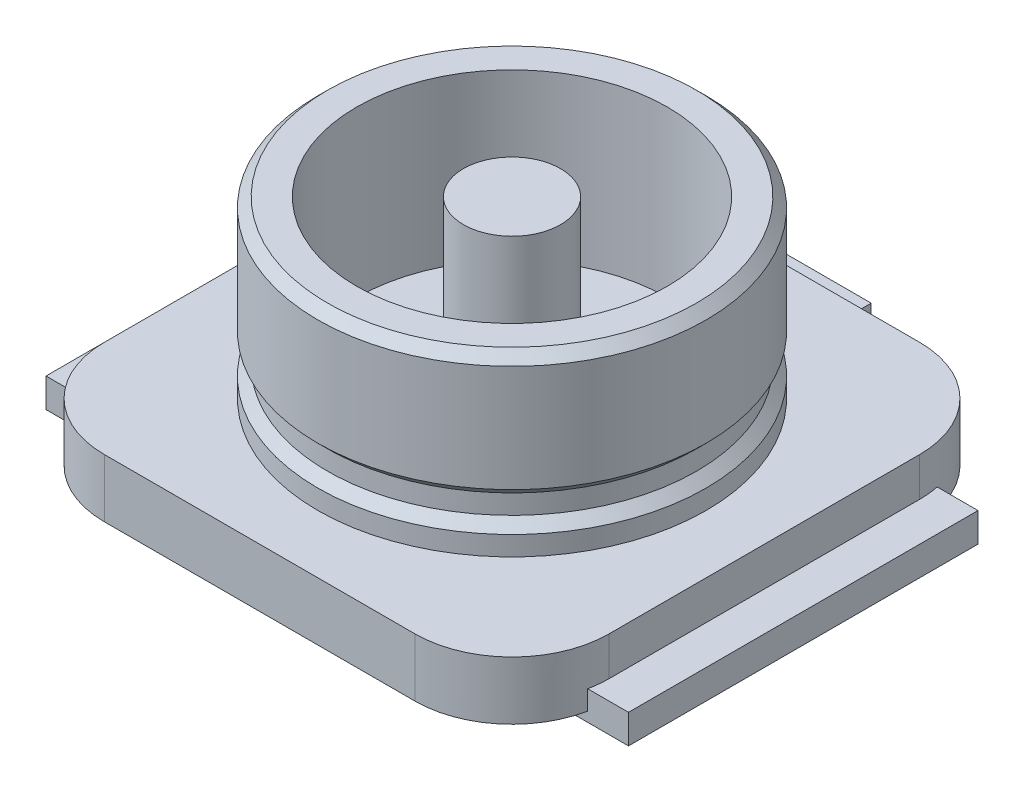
SolidWorks part; units mm, degrees
ref_plane "Front" through (0, 0, 0) normal (0, 0, 1) x (1, 0, 0)
ref_plane "Top" through (0, 0, 0) normal (0, 1, 0) x (1, 0, 0)
ref_plane "Right" through (0, 0, 0) normal (1, 0, 0) x (0, 0, -1)
sketch "Эскиз1" plane through (0, 0, 0) normal (0, 1, 0) x (1, 0, 0)
  line L0 (0, -1.3) -> (0, 1.3) construction
  line L1 (-0.8, -1.3) -> (0.8, -1.3)
  line L2 (-1.3, -0.8) -> (-1.3, 0.8)
  line L3 (-0.8, 1.3) -> (0.8, 1.3)
  line L4 (1.3, -0.8) -> (1.3, 0.8)
  arc A0 (-0.8, -1.3) -> (-1.3, -0.8) centre (-0.8, -0.8) cw
  arc A1 (-1.3, 0.8) -> (-0.8, 1.3) centre (-0.8, 0.8) cw
  arc A2 (0.8, 1.3) -> (1.3, 0.8) centre (0.8, 0.8) cw
  arc A3 (0.8, -1.3) -> (1.3, -0.8) centre (0.8, -0.8) ccw
  dimension "D1" = 0.5
  dimension "D2" = 2.6
extrude "Вытянуть1" add sketch "Эскиз1" along normal blind 0.3 from offset 0.05
sketch "Эскиз2" plane through (0, 0, 0) normal (0, 0, 1) x (1, 0, 0)
  line L0 (0, 0.35) -> (1, 0.35)
  line L1 (-0.8, 0.35) -> (0.8, 0.35) construction
  line L2 (1.3, 0.35) -> (0.8, 0.35) construction
  line L3 (1, 0.35) -> (1, 0.45)
  line L4 (1, 0.45) -> (0.95, 0.5)
  line L5 (0.95, 0.5) -> (0.95, 0.6)
  line L6 (0.95, 0.6) -> (1, 0.65)
  line L7 (1, 0.65) -> (1, 1.2)
  line L8 (1, 1.2) -> (0.95, 1.25)
  line L9 (0.95, 1.25) -> (0.8, 1.25)
  line L10 (0.8, 1.25) -> (0.8, 0.4)
  line L11 (0.8, 0.4) -> (0.25, 0.4)
  line L12 (0.25, 0.4) -> (0.25, 1.25)
  line L13 (0.25, 1.25) -> (0, 1.25)
  line L14 (0, 1.25) -> (0, 0.35) construction
  line L15 (0, 0.35) -> (0, 1.25)
  dimension "D1" = 1.25
  dimension "D2" = 2
  dimension "D3" = 45
  dimension "D4" = 0.1
  dimension "D5" = 0.1
  dimension "D6" = 0.5
  dimension "D7" = 0.05
  dimension "D8" = 1.6
  dimension "D9" = 1.9
revolve "Повернуть1" add sketch "Эскиз2" angle 360 about L14
sketch "Эскиз3" plane through (0, 0, 0) normal (0, 1, 0) x (1, 0, 0)
  line L0 (-0.2, 0.3464) -> (-0.2, 0.95)
  line L1 (-1.5, 0.9) -> (-1.1, 0.9)
  line L2 (-1.5, 0.9) -> (-1.5, -0.9)
  line L3 (-1.5, -0.9) -> (-1.1, -0.9)
  line L4 (-1.1, 0.9) -> (-1.1, -0.9)
  line L5 (-0.3, 1.55) -> (0.3, 1.55)
  line L6 (-0.3, 1.55) -> (-0.3, 0.95)
  line L7 (-0.3, 0.95) -> (-0.2, 0.95)
  line L8 (0.3, 1.55) -> (0.3, 0.95)
  line L9 (0, 0) -> (0, -1.3) construction
  line L10 (-0.8, -1.3) -> (0.8, -1.3) construction
  line L11 (0.2, 0.3464) -> (0.2, 0.95)
  line L12 (1.1, 0.9) -> (1.1, -0.9)
  line L13 (1.5, -0.9) -> (1.1, -0.9)
  line L14 (1.5, 0.9) -> (1.5, -0.9)
  line L15 (1.5, 0.9) -> (1.1, 0.9)
  line L16 (0, 0) -> (-1.3, 0) construction
  line L17 (-1.3, 0.8) -> (-1.3, -0.8) construction
  line L18 (0.2, 0.95) -> (0.3, 0.95)
  arc A0 (-0.2, 0.3464) -> (0.2, 0.3464) centre (0, 0) ccw
  dimension "D8" = 0.4
  dimension "D1" = 3.1
  dimension "D2" = 0.6
  dimension "D3" = 1.8
  dimension "D4" = 3
  dimension "D5" = 2.2
  dimension "D6" = 0.4
  dimension "D7" = 0.95
extrude "Вытянуть2" add sketch "Эскиз3" along normal blind 0.15
